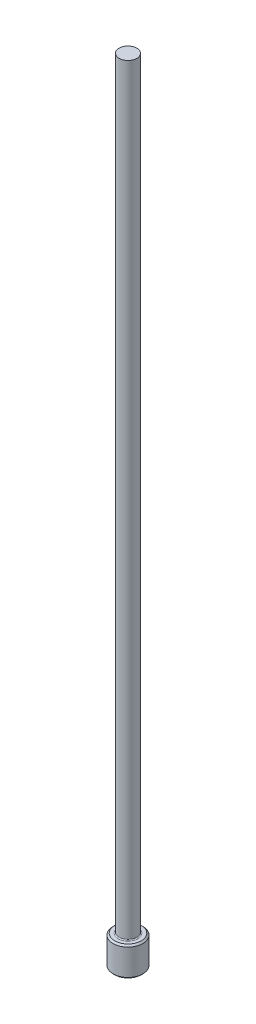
SolidWorks part; units mm, degrees
ref_plane "Front Plane" through (0, 0, 0) normal (0, 0, 1) x (1, 0, 0)
ref_plane "Top Plane" through (0, 0, 0) normal (0, 1, 0) x (1, 0, 0)
ref_plane "Right Plane" through (0, 0, 0) normal (1, 0, 0) x (0, 0, -1)
other "Configuration Table"
sketch "Sketch1" plane through (0, 0, 0) normal (0, 0, 1) x (1, 0, 0)
  line L0 (0, 259.9588) -> (0, -15.1925) construction
  line L1 (0, 0) -> (-1.1938, 0)
  line L2 (-1.1938, 0) -> (-1.1938, 2.3622)
  line L3 (-1.1938, 2.3622) -> (-0.7112, 2.3622)
  line L4 (-0.7112, 2.3622) -> (-0.7112, 63.5)
  line L5 (-0.7112, 63.5) -> (0, 63.5)
  line L6 (0, 63.5) -> (0, 0)
  dimension "L" = 63.5
  dimension "H" = 2.3876
  dimension "T" = 2.3622
  dimension "D" = 1.4224
revolve "Revolve1" add sketch "Sketch1" angle 360 about L0
chamfer "Chamfer1" distance 0.127 angle 45 2 edges at (0, 2.3622, 1.1938) (0, 0, 1.1938)
fillet "Fillet1" radius 0.0762 1 edges at (0, 2.3622, 0.7112)
